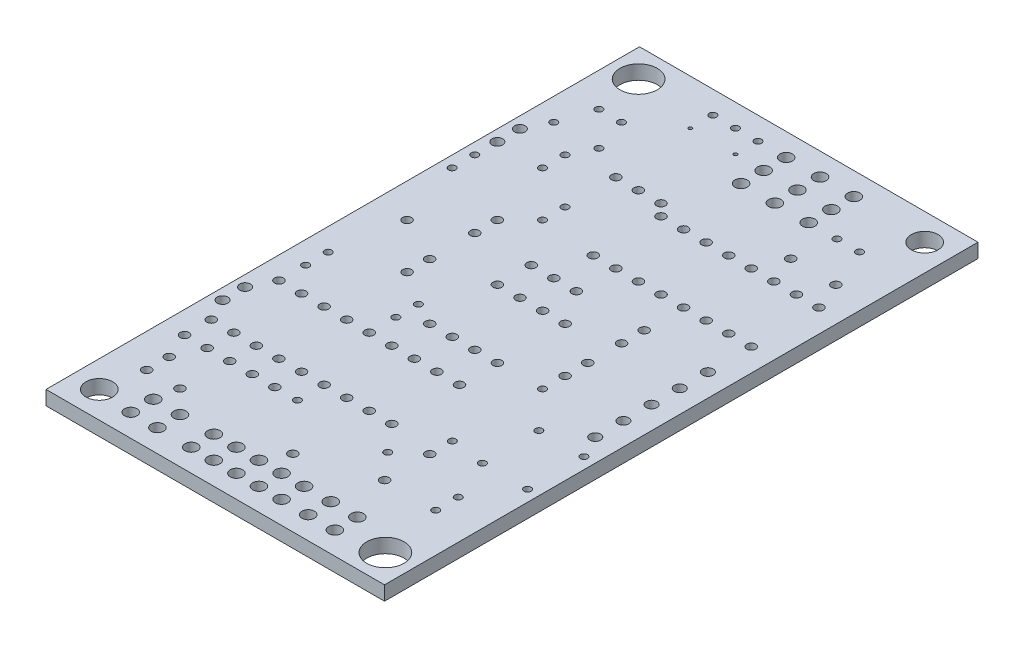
SolidWorks part; units mm, degrees
ref_plane "Plan de face" through (0, 0, 0) normal (0, 0, 1) x (1, 0, 0)
ref_plane "Plan de dessus" through (0, 0, 0) normal (0, 1, 0) x (1, 0, 0)
ref_plane "Plan de droite" through (0, 0, 0) normal (1, 0, 0) x (0, 0, -1)
sketch "Esquisse1" plane through (0, 0, 0) normal (0, 1, 0) x (1, 0, 0)
  line L0 (19.05, -18.6024) -> (19.05, 36.6) construction
  line L1 (0, 0) -> (38.1, 0)
  line L2 (0, 0) -> (0, 66.8)
  line L3 (0, 66.8) -> (38.1, 66.8)
  line L4 (38.1, 0) -> (38.1, 66.8)
  line L5 (-43.89, 33.4) -> (22.9513, 33.4) construction
  line L6 (-43.89, 0) -> (53.1839, 0) construction
  line L7 (0, -18.6024) -> (0, 70.0022) construction
  line L8 (3, -14.9984) -> (3, 4.8521) construction
  line L9 (-2.9942, 3) -> (6.3147, 3) construction
  line L10 (35, -14.9984) -> (35, 5.9155) construction
  line L11 (53.1839, 3.2) -> (33.7505, 3.2) construction
  line L12 (5.1233, 2.54) -> (43.1085, 2.54) construction
  line L13 (5.1233, 5.08) -> (43.1085, 5.08) construction
  line L14 (7, -6.3961) -> (7, 4.1453) construction
  line L15 (10, -6.3961) -> (10, 3.8724) construction
  line L16 (5.7026, 13.1) -> (-7.529, 13.1) construction
  line L17 (2.5, 6.359) -> (2.5, 38.0351) construction
  line L18 (47.7993, 10.16) -> (16.6638, 10.16) construction
  line L19 (33.7, 7.2384) -> (33.7, 11.2585) construction
  line L20 (41.1128, 17.37) -> (30.1351, 17.37) construction
  line L21 (36.83, 24.7137) -> (36.83, 14.83) construction
  line L22 (26.67, 70.4647) -> (26.67, 61.9386) construction
  line L23 (43.1085, 64.26) -> (23.97, 64.26) construction
  circle A0 centre (3, 3) radius 1.5
  circle A1 centre (35, 3.2) radius 2.1
  circle A2 centre (7, 2.54) radius 0.7
  circle A3 centre (3.1, 63.6) radius 2.1
  circle A4 centre (35.1, 63.8) radius 1.5
  circle A5 centre (10, 2.54) radius 0.7
  circle A6 centre (13.81, 2.54) radius 0.7
  circle A7 centre (16.35, 2.54) radius 0.7
  circle A8 centre (18.89, 2.54) radius 0.7
  circle A9 centre (21.43, 2.54) radius 0.7
  circle A10 centre (23.97, 2.54) radius 0.7
  circle A11 centre (26.97, 2.54) radius 0.7
  circle A12 centre (29.97, 2.54) radius 0.7
  circle A13 centre (7, 5.08) radius 0.7
  circle A14 centre (10, 5.08) radius 0.7
  circle A15 centre (13.81, 5.08) radius 0.7
  circle A16 centre (16.35, 5.08) radius 0.7
  circle A17 centre (18.89, 5.08) radius 0.7
  circle A18 centre (21.43, 5.08) radius 0.7
  circle A19 centre (23.97, 5.08) radius 0.7
  circle A20 centre (26.97, 5.08) radius 0.7
  circle A21 centre (29.97, 5.08) radius 0.7
  circle A22 centre (2.5, 13.1) radius 0.5
  circle A23 centre (2.5, 16.1) radius 0.5
  circle A24 centre (1.23, 18.64) radius 0.6
  circle A25 centre (2.5, 26.72) radius 0.4
  circle A26 centre (1.23, 21.18) radius 0.6
  circle A27 centre (2.5, 29.26) radius 0.4
  circle A28 centre (5.04, 13.1) radius 0.5
  circle A29 centre (2.5, 23.72) radius 0.5
  circle A30 centre (5.04, 16.1) radius 0.5
  circle A31 centre (5.04, 23.72) radius 0.5
  circle A32 centre (15.2, 35.61) radius 0.5
  circle A33 centre (15.2, 27.99) radius 0.5
  circle A34 centre (7.58, 13.1) radius 0.5
  circle A35 centre (7.58, 16.1) radius 0.5
  circle A36 centre (7.58, 23.72) radius 0.5
  circle A37 centre (17.74, 27.99) radius 0.5
  circle A38 centre (17.74, 35.61) radius 0.5
  circle A39 centre (10.12, 13.1) radius 0.5
  circle A40 centre (10.12, 16.1) radius 0.5
  circle A41 centre (10.12, 23.72) radius 0.5
  circle A42 centre (20.28, 27.99) radius 0.5
  circle A43 centre (20.28, 35.61) radius 0.5
  circle A44 centre (12.66, 13.1) radius 0.5
  circle A45 centre (12.66, 16.1) radius 0.5
  circle A46 centre (12.66, 23.72) radius 0.5
  circle A47 centre (12.66, 26.72) radius 0.4
  circle A48 centre (12.66, 29.26) radius 0.4
  circle A49 centre (15.2, 13.1) radius 0.4
  circle A50 centre (15.2, 16.1) radius 0.5
  circle A51 centre (15.2, 23.72) radius 0.5
  circle A52 centre (22.82, 27.99) radius 0.5
  circle A53 centre (22.82, 35.61) radius 0.5
  circle A54 centre (7.46, 7.62) radius 0.5
  circle A55 centre (17.74, 16.1) radius 0.5
  circle A56 centre (17.74, 23.72) radius 0.5
  circle A57 centre (20.16, 7.62) radius 0.5
  circle A58 centre (25.36, 13.1) radius 0.4
  circle A59 centre (27.9, 27.99) radius 0.4
  circle A60 centre (20.28, 16.1) radius 0.5
  circle A61 centre (20.28, 23.72) radius 0.5
  circle A62 centre (3.77, 10.1) radius 0.5
  circle A63 centre (3.77, 7.56) radius 0.5
  circle A64 centre (33.7, 10.16) radius 0.4
  circle A65 centre (22.82, 16.1) radius 0.5
  circle A66 centre (22.82, 23.72) radius 0.5
  circle A67 centre (27.9, 17.83) radius 0.4
  circle A68 centre (33.7, 12.7) radius 0.4
  circle A69 centre (27.9, 15.29) radius 0.5
  circle A71 centre (27.9, 10.21) radius 0.5
  circle A87 centre (36.83, 17.37) radius 0.4
  circle A88 centre (27.9, 30.53) radius 0.5
  circle A89 centre (27.9, 33.07) radius 0.5
  circle A90 centre (17.74, 43.86) radius 0.5
  circle A91 centre (27.9, 36.88) radius 0.5
  circle A92 centre (35.56, 26.26) radius 0.6
  circle A93 centre (20.28, 43.86) radius 0.5
  circle A94 centre (22.82, 43.86) radius 0.5
  circle A95 centre (25.36, 43.86) radius 0.5
  circle A96 centre (27.9, 43.86) radius 0.5
  circle A97 centre (35.56, 29.43) radius 0.6
  circle A98 centre (31.75, 17.37) radius 0.4
  circle A99 centre (31.75, 23.72) radius 0.4
  circle A100 centre (36.83, 23.72) radius 0.4
  circle A102 centre (35.56, 32.6) radius 0.6
  circle A104 centre (30.44, 43.86) radius 0.5
  circle A105 centre (32.98, 43.86) radius 0.5
  circle A106 centre (35.52, 43.86) radius 0.5
  circle A107 centre (17.74, 51.48) radius 0.5
  circle A108 centre (20.28, 51.48) radius 0.5
  circle A109 centre (22.82, 51.48) radius 0.5
  circle A110 centre (25.36, 51.48) radius 0.5
  circle A111 centre (27.9, 51.48) radius 0.5
  circle A112 centre (30.44, 51.48) radius 0.5
  circle A113 centre (32.98, 51.48) radius 0.5
  circle A114 centre (35.52, 51.48) radius 0.5
  circle A115 centre (35.56, 35.77) radius 0.6
  circle A116 centre (35.56, 38.94) radius 0.6
  circle A117 centre (26.67, 64.26) radius 0.7
  circle A118 centre (22.86, 64.26) radius 0.7
  circle A119 centre (19.05, 64.26) radius 0.7
  circle A120 centre (15.88, 64.26) radius 0.4
  circle A121 centre (13.34, 64.26) radius 0.4
  circle A122 centre (10.8, 64.26) radius 0.4
  circle A123 centre (26.67, 61.72) radius 0.7
  circle A124 centre (22.86, 61.72) radius 0.7
  circle A125 centre (19.05, 61.72) radius 0.7
  circle A126 centre (15.88, 61.72) radius 0.2
  circle A127 centre (29.84, 59.18) radius 0.4
  circle A128 centre (10.8, 61.72) radius 0.2
  circle A129 centre (26.67, 59.18) radius 0.7
  circle A130 centre (22.86, 59.18) radius 0.7
  circle A131 centre (19.05, 59.18) radius 0.7
  circle A132 centre (32.38, 59.18) radius 0.4
  circle A133 centre (29.17, 54.65) radius 0.5
  circle A134 centre (34.25, 54.65) radius 0.5
  circle A135 centre (13.93, 52.75) radius 0.5
  circle A136 centre (16.47, 52.75) radius 0.5
  circle A137 centre (11.39, 52.75) radius 0.5
  circle A138 centre (15.2, 39.42) radius 0.5
  circle A139 centre (17.74, 39.42) radius 0.5
  circle A140 centre (20.28, 39.42) radius 0.5
  circle A141 centre (1.2691, 52.0684) radius 0.6
  circle A142 centre (1.2691, 49.5284) radius 0.6
  circle A143 centre (1.2691, 46.9884) radius 0.4
  circle A144 centre (1.2691, 44.4484) radius 0.4
  circle A145 centre (27.9, 39.42) radius 0.5
  circle A146 centre (6.3491, 49.5284) radius 0.4
  circle A147 centre (3.8091, 36.8284) radius 0.5
  circle A148 centre (8.8891, 41.9084) radius 0.5
  circle A149 centre (6.3491, 52.0684) radius 0.4
  circle A150 centre (8.8891, 39.3684) radius 0.5
  circle A151 centre (2.54, 54.6101) radius 0.4
  circle A152 centre (7.62, 54.6101) radius 0.4
  circle A153 centre (8.8891, 34.2884) radius 0.5
  circle A154 centre (8.8891, 31.7484) radius 0.5
  circle A155 centre (6.3491, 58.4218) radius 0.4
  circle A156 centre (3.8091, 58.4218) radius 0.4
  circle A157 centre (11.4291, 44.4484) radius 0.4
  circle A158 centre (11.4291, 46.9884) radius 0.4
  dimension "D6" = 3.2
  dimension "D10" = 3
  dimension "D11" = 2
  dimension "D23" = 2
  dimension "D30" = 2
  dimension "D32" = 2
  dimension "D35" = 5
  dimension "D38" = 3
  dimension "D39" = 2
  dimension "D44" = 2
  dimension "D45" = 2
  dimension "D1" = 19.05
  dimension "D2" = 33.4
  dimension "D3" = 32
  dimension "D4" = 3
  dimension "D5" = 3
  dimension "D7" = 2.54
  dimension "D8" = 2.54
  dimension "D9" = 7
  dimension "D15" = 13.1
  dimension "D16" = 2.5
  dimension "D28" = 10.16
  dimension "D29" = 4.4
  dimension "D31" = 1.27
  dimension "D36" = 11.43
  dimension "D37" = 2.54
  dimension "D12" = 5
  dimension "D13" = 3
  dimension "D14" = 2
  dimension "D21" = 2
  dimension "D22" = 4
  dimension "D33" = 2
  dimension "D26" = 2
  dimension "D27" = 6
  dimension "D34" = 2
  dimension "D40" = 3
  dimension "D41" = 2
  dimension "D42" = 3
  dimension "D43" = 2
  dimension "D46" = 2
  dimension "D47" = 2
extrude "Boss.-Extru.1" add sketch "Esquisse1" along normal blind 1.6
